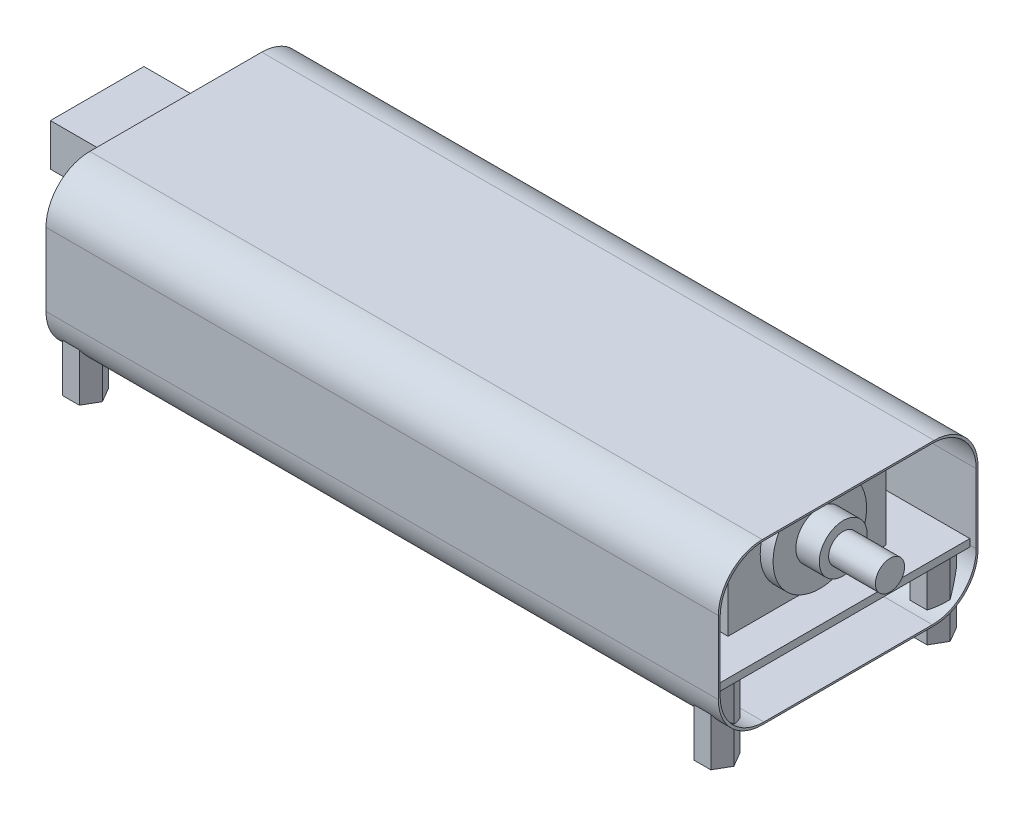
SolidWorks part; units mm, degrees
ref_plane "FRONT" through (0, 0, 0) normal (0, 0, 1) x (1, 0, 0)
ref_plane "TOP" through (0, 0, 0) normal (0, 1, 0) x (1, 0, 0)
ref_plane "RIGHT" through (0, 0, 0) normal (1, 0, 0) x (0, 0, -1)
sketch "Sketch1" plane through (0, 0, 0) normal (0, 1, 0) x (1, 0, 0)
  line L0 (0, 0) -> (145.034, 0)
  line L1 (0, 0) -> (0, 54.991)
  line L2 (145.034, 54.991) -> (0, 54.991)
  line L3 (145.034, 54.991) -> (145.034, 0)
  dimension "D1" = 145.034
  dimension "D2" = 54.991
extrude "Base-Extrude" add sketch "Sketch1" along normal blind 1.6002
sketch "Sketch2" plane through (0, 1.6002, 0) normal (0, 1, 0) x (-1, 0, 0)
  line L0 (0, 0) -> (-87.884, 0)
  line L1 (0, 0) -> (0, -54.991)
  line L2 (-87.884, -54.991) -> (0, -54.991)
  line L3 (-87.884, -54.991) -> (-87.884, 0)
  line L4 (-145.034, -54.991) -> (0, -54.991) construction
  dimension "D1" = 87.884
extrude "Boss-Extrude1" add sketch "Sketch2" along normal blind 12.7
sketch "Sketch16" plane through (0, 0, 0) normal (-1, 0, 0) x (0, 0, 1)
  line L0 (0, 0) -> (-54.991, 0) construction
  line L1 (-37.6555, 8.89) -> (-17.3355, 8.89)
  line L2 (-37.6555, 8.89) -> (-37.6555, 18.034)
  line L3 (-37.6555, 18.034) -> (-17.3355, 18.034)
  line L4 (-17.3355, 8.89) -> (-17.3355, 18.034)
  line L5 (-27.4955, 8.89) -> (-27.4955, 0) construction
  dimension "D1" = 8.89
  dimension "D2" = 9.144
  dimension "D3" = 20.32
extrude "Conn Comm" add sketch "Sketch16" along normal blind 17.018 and the other way blind 6.35
sketch "Sketch17" plane through (0, 1.6002, 0) normal (0, 1, 0) x (-1, 0, 0)
  line L0 (-87.884, -54.991) -> (0, -54.991) construction
  line L1 (-2.54, -52.451) -> (-7.62, -52.451)
  line L2 (-2.54, -52.451) -> (-2.54, -42.291)
  line L3 (-2.54, -42.291) -> (-7.62, -42.291)
  line L4 (-7.62, -52.451) -> (-7.62, -42.291)
  line L5 (-33.02, -7.62) -> (-40.64, -7.62)
  line L6 (-33.02, -7.62) -> (-33.02, -5.08)
  line L7 (-33.02, -5.08) -> (-40.64, -5.08)
  line L8 (-40.64, -7.62) -> (-40.64, -5.08)
  line L9 (0, -37.6555) -> (0, -54.991) construction
  line L10 (0, 0) -> (-87.884, 0) construction
  line L11 (0, 0) -> (0, -17.3355) construction
  dimension "D1" = 10.16
  dimension "D2" = 5.08
  dimension "D3" = 2.54
  dimension "D4" = 2.54
  dimension "D5" = 5.08
  dimension "D6" = 7.62
  dimension "D7" = 2.54
  dimension "D8" = 33.02
extrude "Conn Pins" add sketch "Sketch17" along direction (0, -1, 0) on the side of the normal blind 16.51 separate body
sketch "Sketch14" plane through (0, 0, 0) normal (0, -1, 0) x (1, 0, 0)
  line L1 (57.7366, -8.0534) -> (77.7894, -8.0534)
  line L2 (57.7366, -8.0534) -> (57.7366, -20.7534)
  line L3 (57.7366, -20.7534) -> (77.7894, -20.7534)
  line L4 (77.7894, -8.0534) -> (77.7894, -20.7534)
  line L5 (57.7366, -32.1084) -> (77.7894, -32.1084)
  line L6 (57.7366, -32.1084) -> (57.7366, -44.8084)
  line L7 (57.7366, -44.8084) -> (77.7894, -44.8084)
  line L8 (77.7894, -32.1084) -> (77.7894, -44.8084)
  dimension "D1" = 12.7
extrude "Coils" add sketch "Sketch14" along normal blind 9.525
sketch "Sketch3" plane through (0, 1.6002, 0) normal (0, 1, 0) x (-1, 0, 0)
  line L0 (-117.0305, -27.4955) -> (-145.796, -27.4955) construction
  line L1 (-145.034, -27.4955) -> (-124.714, -27.4955) construction
  line L2 (-145.034, -54.991) -> (-145.034, 0) construction
  line L3 (-137.16, -10.3505) -> (-137.16, -44.6405)
  line L4 (-137.16, -44.6405) -> (-124.714, -44.6405)
  line L5 (-137.16, -10.3505) -> (-124.714, -10.3505)
  line L6 (-124.714, -44.6405) -> (-124.714, -10.3505)
  point P7 (-137.16, -27.4955)
  point P10 (-124.714, -27.4955)
  dimension "D1" = 12.446
  dimension "D2" = 34.29
  dimension "D3" = 20.32
  dimension "D4" = 90
extrude "Boss-Extrude2" add sketch "Sketch3" along normal blind 22.606
ref_plane "Plane4" through (0, 13.5382, 0) normal (0, 1, 0) x (-1, 0, 0)
sketch "Sketch4" plane through (0, 13.5382, 0) normal (0, 1, 0) x (-1, 0, 0)
  line L0 (-137.16, -27.4955) -> (-155.194, -27.4955) construction
  line L1 (-137.16, -10.3505) -> (-137.16, -44.6405) construction
  line L2 (-155.194, -27.4955) -> (-155.194, -30.6705)
  line L3 (-155.194, -30.6705) -> (-145.034, -30.6705)
  line L4 (-145.034, -30.6705) -> (-145.034, -32.7025)
  line L5 (-145.034, -32.7025) -> (-139.954, -32.7025)
  line L6 (-139.954, -32.7025) -> (-139.954, -37.6555)
  line L7 (-139.954, -37.6555) -> (-137.16, -37.6555)
  line L8 (-137.16, -37.6555) -> (-137.16, -27.4955)
  line L9 (-137.16, -27.4955) -> (-155.194, -27.4955)
  point P17 (-155.194, -27.4955)
  dimension "D1" = 3.175
  dimension "D2" = 5.207
  dimension "D3" = 10.16
  dimension "D4" = 10.16
  dimension "D5" = 5.08
  dimension "D6" = 2.794
revolve "Boss-Revolve1" add sketch "Sketch4" angle 360 about L0
sketch "Sketch5" plane through (0, 13.5382, 0) normal (0, 1, 0) x (-1, 0, 0)
  line L0 (-124.714, -27.4955) -> (-108.889, -27.4955) construction
  line L1 (-124.714, -44.6405) -> (-124.714, -10.3505) construction
  line L2 (-124.714, -27.4955) -> (-124.714, -36.3855)
  line L3 (-124.714, -36.3855) -> (-122.936, -36.3855)
  line L4 (-122.936, -36.3855) -> (-122.936, -38.6715)
  line L5 (-122.936, -38.6715) -> (-105.918, -38.6715)
  line L6 (-105.918, -38.6715) -> (-105.918, -31.9405)
  line L7 (-105.918, -31.9405) -> (-96.393, -31.9405)
  line L8 (-96.393, -31.9405) -> (-96.393, -27.4955)
  line L9 (-96.393, -27.4955) -> (-124.714, -27.4955)
  line L10 (-124.714, -44.6405) -> (-124.714, -10.3505) construction
  dimension "D1" = 8.89
  dimension "D2" = 11.176
  dimension "D3" = 4.445
  dimension "D4" = 1.778
  dimension "D5" = 17.018
  dimension "D6" = 9.525
revolve "Boss-Revolve2" add sketch "Sketch5" angle 360 about L0
ref_plane "Plane5" through (0, 0, -27.4955) normal (0, 0, -1) x (-1, 0, 0)
sketch "Sketch6" plane through (0, 0, 0) normal (0, -1, 0) x (1, 0, 0)
  line L0 (0, 0) -> (145.034, 0) construction
  line L1 (139.2639, -7.1755) -> (142.9301, -7.1755)
  line L2 (142.9301, -7.1755) -> (144.7632, -4.0005)
  line L3 (144.7632, -4.0005) -> (142.9301, -0.8255)
  line L4 (142.9301, -0.8255) -> (139.2639, -0.8255)
  line L5 (139.2639, -0.8255) -> (137.4308, -4.0005)
  line L6 (137.4308, -4.0005) -> (139.2639, -7.1755)
  line L7 (137.4308, -50.9905) -> (139.2639, -54.1655)
  line L8 (139.2639, -54.1655) -> (142.9301, -54.1655)
  line L9 (142.9301, -54.1655) -> (144.7632, -50.9905)
  line L10 (144.7632, -50.9905) -> (142.9301, -47.8155)
  line L11 (142.9301, -47.8155) -> (139.2639, -47.8155)
  line L12 (139.2639, -47.8155) -> (137.4308, -50.9905)
  line L13 (145.034, -54.991) -> (145.034, 0) construction
  line L15 (2.1039, -7.1755) -> (5.7701, -7.1755)
  line L16 (5.7701, -7.1755) -> (7.6032, -4.0005)
  line L17 (7.6032, -4.0005) -> (5.7701, -0.8255)
  line L18 (5.7701, -0.8255) -> (2.1039, -0.8255)
  line L19 (2.1039, -0.8255) -> (0.2708, -4.0005)
  line L20 (0.2708, -4.0005) -> (2.1039, -7.1755)
  line L21 (0.2708, -50.9905) -> (2.1039, -54.1655)
  line L22 (2.1039, -54.1655) -> (5.7701, -54.1655)
  line L23 (5.7701, -54.1655) -> (7.6032, -50.9905)
  line L24 (7.6032, -50.9905) -> (5.7701, -47.8155)
  line L25 (5.7701, -47.8155) -> (2.1039, -47.8155)
  line L26 (2.1039, -47.8155) -> (0.2708, -50.9905)
  line L27 (3.937, -4.0005) -> (141.097, -50.9905) construction
  line L28 (3.937, -4.0005) -> (141.097, -4.0005) construction
  line L29 (3.937, -4.0005) -> (3.937, -50.9905) construction
  line L30 (3.937, -50.9905) -> (141.097, -50.9905) construction
  line L31 (141.097, -4.0005) -> (141.097, -50.9905) construction
  line L32 (0, -54.991) -> (145.034, 0) construction
  circle A0 centre (141.097, -4.0005) radius 3.175 construction
  circle A1 centre (141.097, -50.9905) radius 3.175 construction
  circle A2 centre (3.937, -4.0005) radius 3.175 construction
  circle A3 centre (3.937, -50.9905) radius 3.175 construction
  circle A4 centre (3.937, -4.0005) radius 1.27
  circle A5 centre (141.097, -4.0005) radius 1.27
  circle A6 centre (141.097, -50.9905) radius 1.27
  circle A7 centre (3.937, -50.9905) radius 1.27
  point P38 (72.517, -27.4955)
  dimension "D1" = 6.35
  dimension "D2" = 6.35
  dimension "D4" = 46.99
  dimension "D6" = 6.35
  dimension "D7" = 6.35
  dimension "D3" = 2.54
  dimension "D8" = 137.16
  dimension "D9" = 46.99
extrude "HexStndOff" add sketch "Sketch6" along normal blind 15.875
sketch "Sketch7" plane through (0, 0, 0) normal (1, 0, 0) x (0, 0, -1)
  line L0 (9.271, 24.5872) -> (45.847, 24.5872)
  line L1 (8.89, 24.9682) -> (46.228, 24.9682)
  line L2 (-0.635, 15.4432) -> (-0.635, -0.381)
  line L3 (8.89, -9.906) -> (46.228, -9.906)
  line L4 (55.753, 15.4432) -> (55.753, -0.381)
  line L5 (55.372, 15.0622) -> (55.372, 0)
  line L6 (9.271, -9.525) -> (45.847, -9.525)
  line L7 (-0.254, 15.0622) -> (-0.254, 0)
  line L8 (44.6405, 24.2062) -> (10.3505, 24.2062) construction
  line L9 (54.991, 0) -> (0, 0) construction
  line L10 (54.991, 14.3002) -> (54.991, 0) construction
  arc A1 (45.847, 24.5872) -> (55.372, 15.0622) centre (45.847, 15.0622) cw
  arc A2 (46.228, 24.9682) -> (55.753, 15.4432) centre (46.228, 15.4432) cw
  arc A3 (9.271, 24.5872) -> (-0.254, 15.0622) centre (9.271, 15.0622) ccw
  arc A4 (8.89, 24.9682) -> (-0.635, 15.4432) centre (8.89, 15.4432) ccw
  arc A5 (55.372, 0) -> (45.847, -9.525) centre (45.847, 0) cw
  arc A6 (46.228, -9.906) -> (55.753, -0.381) centre (46.228, -0.381) ccw
  arc A7 (9.271, -9.525) -> (-0.254, 0) centre (9.271, 0) cw
  arc A8 (-0.635, -0.381) -> (8.89, -9.906) centre (8.89, -0.381) ccw
  point P14 (55.753, 24.9682)
  point P19 (-0.635, 24.9682)
  point P28 (-0.635, -9.906)
  dimension "D3" = 0.762
  dimension "D4" = 0.762
  dimension "D6" = 9.525
  dimension "D1" = 56.388
  dimension "D2" = 9.525
  dimension "D5" = 0.381
extrude "Shield" add sketch "Sketch7" along normal blind 146.05
sketch "Fiber ends" plane through (155.194, 0, 0) normal (1, 0, 0) x (0, 0, -1)
  circle A0 centre (25.9715, 13.5382) radius 1.397
  circle A1 centre (29.0195, 13.5382) radius 1.397
  circle A2 centre (27.4955, 13.5382) radius 3.175 construction
  point P0 (27.4955, 13.5382)
  dimension "D1" = 2.794
  dimension "D2" = 1.524
  dimension "D3" = 1.524
sketch "Fiber paths" plane through (0, 13.5382, 0) normal (0, 1, 0) x (-1, 0, 0)
  line L0 (-155.194, -29.0195) -> (-167.894, -29.0195)
  line L1 (-155.194, -25.9715) -> (-167.894, -25.9715)
  line L2 (-155.194, -29.0195) -> (-155.194, -25.9715) construction
  dimension "D1" = 12.7
sketch "Sketch18" plane through (0, -9.906, 0) normal (0, -1, 0) x (1, 0, 0)
  circle A1 centre (3.937, -50.9905) radius 1.27
  circle A2 centre (3.937, -50.9905) radius 1.27
  circle A3 centre (141.097, -50.9905) radius 1.27
  circle A4 centre (141.097, -50.9905) radius 1.27
  circle A5 centre (141.097, -4.0005) radius 1.27
  circle A6 centre (141.097, -4.0005) radius 1.27
  circle A7 centre (3.937, -4.0005) radius 1.27
  circle A8 centre (3.937, -4.0005) radius 1.27
  dimension "D4" = 0
  dimension "D5" = 0
  dimension "D6" = 0
  dimension "D7" = 0
extrude "Cut-Extrude1" cut sketch "Sketch18" against normal blind 6.35
